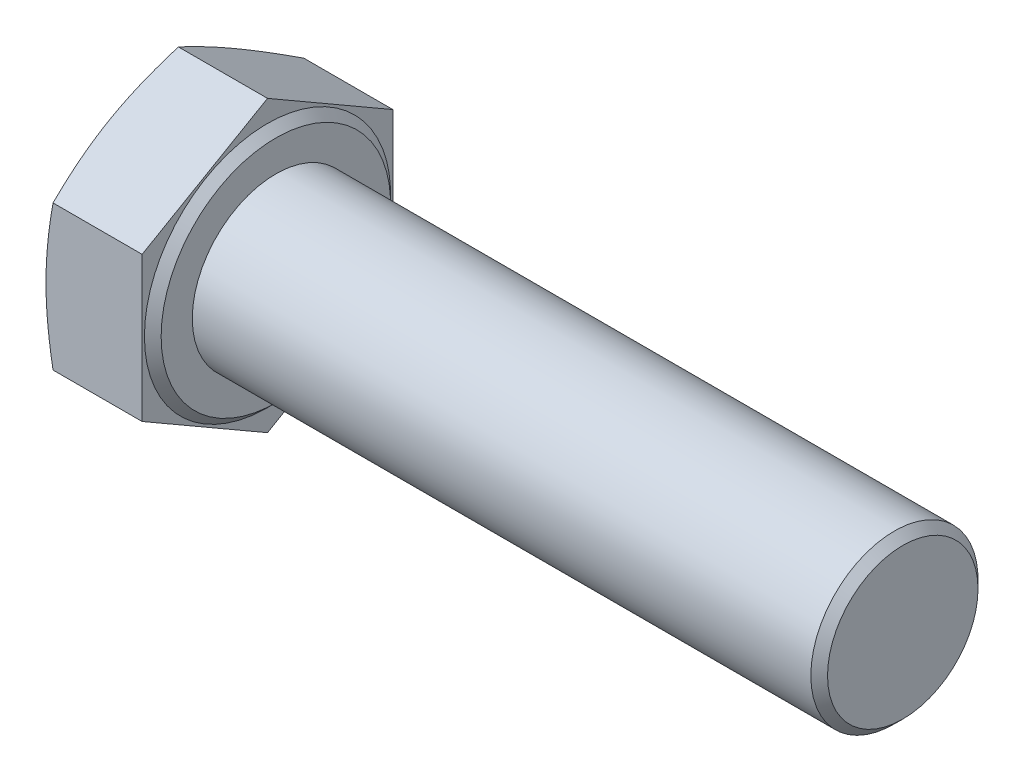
SolidWorks part; units mm, degrees
ref_plane "Front" through (0, 0, 0) normal (0, 0, 1) x (1, 0, 0)
ref_plane "Top" through (0, 0, 0) normal (0, 1, 0) x (1, 0, 0)
ref_plane "Right" through (0, 0, 0) normal (1, 0, 0) x (0, 0, -1)
sketch "Sketch2" plane through (0, 0, 0) normal (1, 0, 0) x (0, 0, -1)
  line L1 (0, -10.3923) -> (9, -5.1962)
  line L2 (9, -5.1962) -> (9, 5.1962)
  line L3 (9, 5.1962) -> (0, 10.3923)
  line L4 (0, 10.3923) -> (-9, 5.1962)
  line L5 (-9, 5.1962) -> (-9, -5.1962)
  line L6 (-9, -5.1962) -> (0, -10.3923)
  circle A0 centre (0, 0) radius 9 construction
extrude "BaseHead" add sketch "Sketch2" along normal blind 7.5
sketch "Sketch3" plane through (0, 0, 0) normal (0, 0, 1) x (1, 0, 0)
  line L0 (7.5, 10.3923) -> (7.5, 8.235)
  line L2 (7.5, 8.235) -> (6.9, 8.835)
  line L3 (6.9, 8.835) -> (6.9, 10.3923)
  line L5 (6.9, 10.3923) -> (7.5, 10.3923)
  line L6 (-0.9571, 0) -> (7.6478, 0) construction
  line L7 (7.5, 10.3923) -> (0, 10.3923) construction
  dimension "D1" = 45
  dimension "c" = 0.6
  dimension "dw" = 16.47
revolve "BearingFace" cut sketch "Sketch3" angle 360 about L6
sketch "Sketch4" plane through (0, 0, 0) normal (0, 0, 1) x (1, 0, 0)
  line L0 (-0.4935, 0) -> (3.5626, 0) construction
  line L2 (0, 10.3923) -> (0.5068, 10.3923)
  line L4 (0.5068, 10.3923) -> (0, 9)
  line L6 (0, 9) -> (0, 10.3923)
  line L7 (6.9, 10.3923) -> (0, 10.3923) construction
revolve "HeadChamfer" cut sketch "Sketch4" angle 360 about L0
sketch "Sketch5" plane through (7.5, 0, 0) normal (1, 0, 0) x (0, 0, -1)
  circle A0 centre (0, 0) radius 6
extrude "BaseBody" add sketch "Sketch5" along normal blind 45
chamfer "Chamfer1" distance 0.6 angle 45 1 edges at (52.5, 0, -6)
fillet "HeadFillet" [suppressed] radius 0.6
sketch "Sketch6" plane through (0, 0, 0) normal (0, 0, 1) x (1, 0, 0)
  line L0 (7.5, 6.947) -> (8.447, 6.947)
  line L1 (8.447, 6.947) -> (8.447, 6)
  line L2 (8.447, 6) -> (7.9735, 5.1799)
  line L3 (7.9735, 5.1799) -> (7.5, 6)
  line L4 (7.5, 6) -> (7.5, 6.947)
  line L5 (7.5, -8.235) -> (7.5, 8.235) construction
  line L6 (51.9, 6) -> (7.5, 6) construction
revolve "Cut-Revolve10" [suppressed] cut sketch "Sketch6" angle 360
pattern_linear "LPattern10" [suppressed] count 39
equation "\"D2@Sketch4\" = \"s@Sketch2\""
equation "\"D1@Chamfer1\" = 0.05 * \"d@Sketch5\""
equation "\"D1@Sketch6\" =  ( \"d@Sketch5\" - \"D2@ThreadCosmetic1\" )  / 2"
equation "\"pitch@LPattern10\" = 1.2 * \"D1@Sketch6\""
equation "\"D1@LPattern10\" = (  \"l@BaseBody\"-\"D1@Chamfer1\" )  / \"pitch@LPattern10\""
